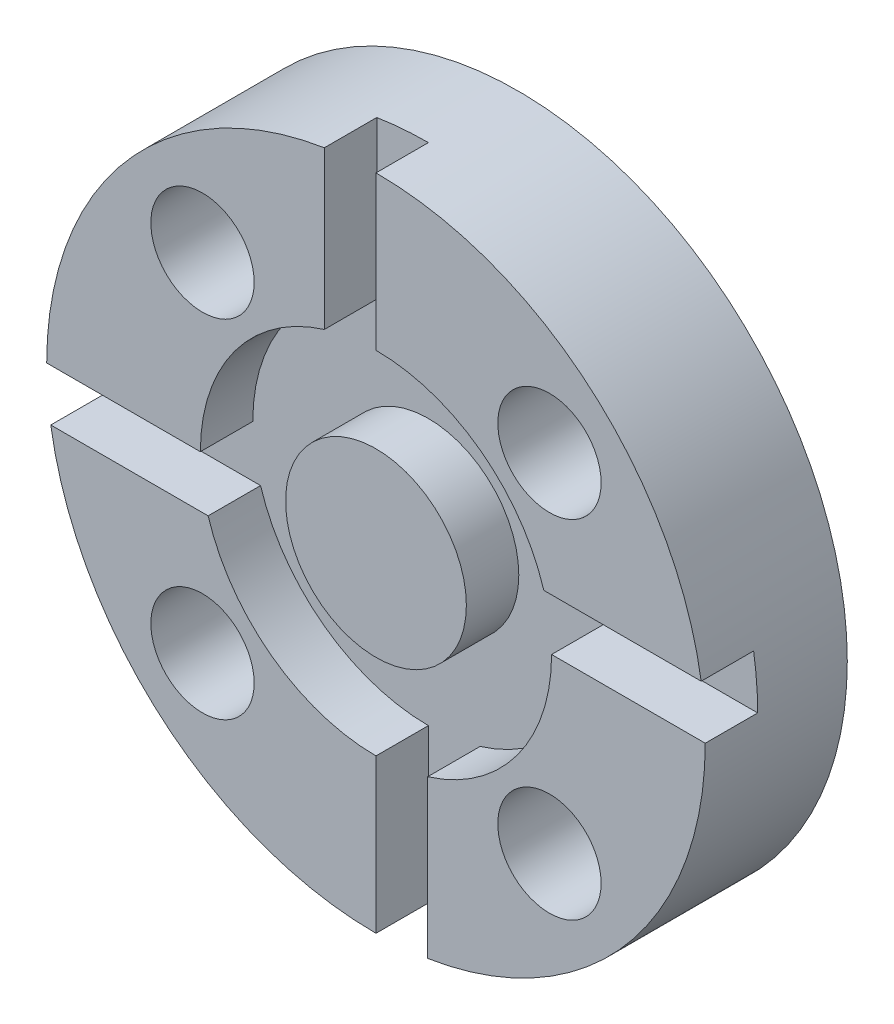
SolidWorks part; units mm, degrees
ref_plane "Face" through (0, 0, 0) normal (0, 0, 1) x (1, 0, 0)
ref_plane "Dessus" through (0, 0, 0) normal (0, 1, 0) x (1, 0, 0)
ref_plane "Droite" through (0, 0, 0) normal (1, 0, 0) x (0, 0, -1)
sketch "Esquisse1" plane through (0, 0, 0) normal (0, 0, 1) x (1, 0, 0)
  line L0 (-134.1645, 0) -> (139.2343, 0) construction
  line L1 (0, 0) -> (-114.0466, 114.0466) construction
  line L2 (67.1751, 67.1751) -> (0, 0) construction
  line L3 (0, 0) -> (-67.1751, -67.1751) construction
  line L4 (0, 0) -> (67.1751, -67.1751) construction
  circle A0 centre (0, 0) radius 127.5
  circle A1 centre (-67.1751, 67.1751) radius 20
  circle A2 centre (67.1751, 67.1751) radius 20
  circle A3 centre (67.1751, -67.1751) radius 20
  circle A4 centre (-67.1751, -67.1751) radius 20
  dimension "D1" = 255
  dimension "D3" = 40
  dimension "D4" = 95
  dimension "D5" = 95
  dimension "D6" = 95
  dimension "D7" = 90
  dimension "D2" = 45
  dimension "D8" = 90
  dimension "D9" = 90
extrude "Extrusion1" add sketch "Esquisse1" along normal blind 55
sketch "Esquisse2" plane through (0, 0, 55) normal (0, 0, 1) x (1, 0, 0)
  circle A0 centre (0, 0) radius 68
  circle A1 centre (0, 0) radius 35
  dimension "D1" = 136
  dimension "D2" = 70
extrude "Enlèv. mat.-Extru.1" cut sketch "Esquisse2" against normal blind 20.3
sketch "Esquisse3" plane through (0, 0, 55) normal (0, 0, 1) x (1, 0, 0)
  line L0 (-35, 0) -> (-140, 0)
  line L1 (-140, 0) -> (-140, -20)
  line L2 (-140, -20) -> (-28.7228, -20)
  line L5 (0, -35) -> (0, -153.9931)
  line L6 (0, -153.9931) -> (20, -153.9931)
  line L7 (20, -28.7228) -> (20, -153.9931)
  line L8 (35, 0) -> (138.374, 0)
  line L10 (28.7228, 20) -> (138.374, 20)
  line L11 (138.374, 0) -> (138.374, 20)
  line L13 (0, 35) -> (0, 137.0156)
  line L14 (0, 137.0156) -> (-20, 137.0156)
  line L15 (-20, 28.7228) -> (-20, 137.0156)
  circle A0 centre (0, 0) radius 35 construction
  arc A1 (0, 35) -> (-20, 28.7228) centre (0, 0) ccw
  arc A2 (-35, 0) -> (-28.7228, -20) centre (0, 0) ccw
  arc A3 (0, -35) -> (20, -28.7228) centre (0, 0) ccw
  arc A4 (35, 0) -> (28.7228, 20) centre (0, 0) ccw
  dimension "D2" = 140
  dimension "D1" = 20
  dimension "D3" = 20
  dimension "D4" = 20
  dimension "D5" = 20
extrude "Enlèv. mat.-Extru.2" cut sketch "Esquisse3" against normal blind 20.3
